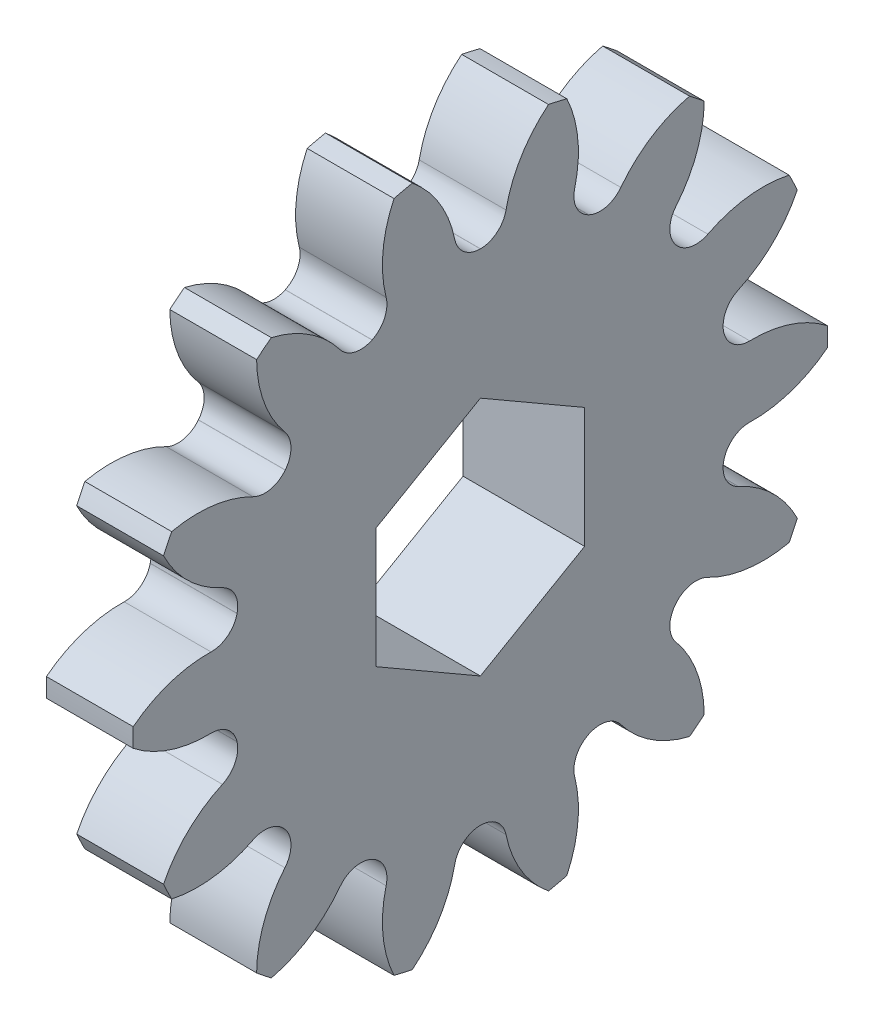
SolidWorks part; units mm, degrees
ref_plane "Front Plane" through (0, 0, 0) normal (0, 0, 1) x (1, 0, 0)
ref_plane "Top Plane" through (0, 0, 0) normal (0, 1, 0) x (1, 0, 0)
ref_plane "Right Plane" through (0, 0, 0) normal (1, 0, 0) x (0, 0, -1)
ref_plane "Plane1" through (0, 0, 0) normal (0, 0, -1) x (-1, 0, 0)
sketch "Sketch1" plane through (0, 0, 0) normal (0, 0, -1) x (-1, 0, 0)
  line L0 (-10, 40) -> (-10, 0)
  line L1 (-10, 0) -> (0, 0)
  line L2 (0, 0) -> (0, 40)
  line L3 (0, 40) -> (-10, 40)
  line L4 (-10, 0) -> (0, 0) construction
  dimension "D1" = 40
  dimension "D2" = 10
revolve "Revolve1" add sketch "Sketch1" angle 360 about L4
sketch "Sketch2" plane through (10, 0, 0) normal (1, 0, 0) x (0, 0, -1)
  arc A0 (35.5563, 18.3234) -> (25.7761, 30.5875) centre (0, 0) ccw
  arc A1 (25.7761, 30.5875) -> (20.7157, 19.934) centre (11.7766, 30.7085) cw
  arc A2 (20.7157, 19.934) -> (24.0439, 15.7606) centre (0, 0) cw
  arc A3 (24.0439, 15.7606) -> (35.5563, 18.3234) centre (32.5591, 4.648) cw
extrude "Cut-Extrude1" cut sketch "Sketch2" against normal through all
sketch "Sketch3" plane through (10, 0, 0) normal (1, 0, 0) x (0, 0, -1)
  arc A0 (39.9854, 1.0815) -> (36.4948, 16.3746) centre (0, 0) ccw
  arc A1 (36.4948, 16.3746) -> (27.3133, 8.9717) centre (23.9343, 22.5578) cw
  arc A2 (27.3133, 8.9717) -> (28.5011, 3.7676) centre (0, 0) cw
  arc A3 (28.5011, 3.7676) -> (39.9854, 1.0815) centre (31.3515, -9.9392) cw
extrude "Cut-Extrude2" cut sketch "Sketch3" against normal through all
sketch "Sketch4" plane through (10, 0, 0) normal (1, 0, 0) x (0, 0, -1)
  arc A0 (36.4948, -16.3746) -> (39.9854, -1.0815) centre (0, 0) ccw
  arc A1 (39.9854, -1.0815) -> (28.5011, -3.7676) centre (31.3515, 9.9392) cw
  arc A2 (28.5011, -3.7676) -> (27.3133, -8.9717) centre (0, 0) cw
  arc A3 (27.3133, -8.9717) -> (36.4948, -16.3746) centre (23.9343, -22.5578) cw
extrude "Cut-Extrude3" cut sketch "Sketch4" against normal through all
sketch "Sketch5" plane through (10, 0, 0) normal (1, 0, 0) x (0, 0, -1)
  arc A0 (25.7761, -30.5875) -> (35.5563, -18.3234) centre (0, 0) ccw
  arc A1 (35.5563, -18.3234) -> (24.0439, -15.7606) centre (32.5591, -4.648) cw
  arc A2 (24.0439, -15.7606) -> (20.7157, -19.934) centre (0, 0) cw
  arc A3 (20.7157, -19.934) -> (25.7761, -30.5875) centre (11.7766, -30.7085) cw
extrude "Cut-Extrude4" cut sketch "Sketch5" against normal through all
sketch "Sketch6" plane through (10, 0, 0) normal (1, 0, 0) x (0, 0, -1)
  arc A0 (9.952, -38.7422) -> (24.0849, -31.9362) centre (0, 0) ccw
  arc A1 (24.0849, -31.9362) -> (14.8245, -24.6321) centre (27.3181, -18.3146) cw
  arc A2 (14.8245, -24.6321) -> (10.0152, -26.9481) centre (0, 0) cw
  arc A3 (10.0152, -26.9481) -> (9.952, -38.7422) centre (-2.7136, -32.7771) cw
extrude "Cut-Extrude5" cut sketch "Sketch6" against normal through all
sketch "Sketch7" plane through (10, 0, 0) normal (1, 0, 0) x (0, 0, -1)
  arc A0 (-7.8432, -39.2235) -> (7.8432, -39.2235) centre (0, 0) ccw
  arc A1 (7.8432, -39.2235) -> (2.669, -28.6248) centre (16.6663, -28.3538) cw
  arc A2 (2.669, -28.6248) -> (-2.669, -28.6248) centre (0, 0) cw
  arc A3 (-2.669, -28.6248) -> (-7.8432, -39.2235) centre (-16.6663, -28.3538) cw
extrude "Cut-Extrude6" cut sketch "Sketch7" against normal through all
sketch "Sketch8" plane through (10, 0, 0) normal (1, 0, 0) x (0, 0, -1)
  arc A0 (-24.0849, -31.9362) -> (-9.952, -38.7422) centre (0, 0) ccw
  arc A1 (-9.952, -38.7422) -> (-10.0152, -26.9481) centre (2.7136, -32.7771) cw
  arc A2 (-10.0152, -26.9481) -> (-14.8245, -24.6321) centre (0, 0) cw
  arc A3 (-14.8245, -24.6321) -> (-24.0849, -31.9362) centre (-27.3181, -18.3146) cw
extrude "Cut-Extrude7" cut sketch "Sketch8" against normal through all
sketch "Sketch9" plane through (10, 0, 0) normal (1, 0, 0) x (0, 0, -1)
  arc A0 (-35.5563, -18.3234) -> (-25.7761, -30.5875) centre (0, 0) ccw
  arc A1 (-25.7761, -30.5875) -> (-20.7157, -19.934) centre (-11.7766, -30.7085) cw
  arc A2 (-20.7157, -19.934) -> (-24.0439, -15.7606) centre (0, 0) cw
  arc A3 (-24.0439, -15.7606) -> (-35.5563, -18.3234) centre (-32.5591, -4.648) cw
extrude "Cut-Extrude8" cut sketch "Sketch9" against normal through all
sketch "Sketch10" plane through (10, 0, 0) normal (1, 0, 0) x (0, 0, -1)
  arc A0 (-39.9854, -1.0815) -> (-36.4948, -16.3746) centre (0, 0) ccw
  arc A1 (-36.4948, -16.3746) -> (-27.3133, -8.9717) centre (-23.9343, -22.5578) cw
  arc A2 (-27.3133, -8.9717) -> (-28.5011, -3.7676) centre (0, 0) cw
  arc A3 (-28.5011, -3.7676) -> (-39.9854, -1.0815) centre (-31.3515, 9.9392) cw
extrude "Cut-Extrude9" cut sketch "Sketch10" against normal through all
sketch "Sketch11" plane through (10, 0, 0) normal (1, 0, 0) x (0, 0, -1)
  arc A0 (-36.4948, 16.3746) -> (-39.9854, 1.0815) centre (0, 0) ccw
  arc A1 (-39.9854, 1.0815) -> (-28.5011, 3.7676) centre (-31.3515, -9.9392) cw
  arc A2 (-28.5011, 3.7676) -> (-27.3133, 8.9717) centre (0, 0) cw
  arc A3 (-27.3133, 8.9717) -> (-36.4948, 16.3746) centre (-23.9343, 22.5578) cw
extrude "Cut-Extrude10" cut sketch "Sketch11" against normal through all
sketch "Sketch12" plane through (10, 0, 0) normal (1, 0, 0) x (0, 0, -1)
  arc A0 (-25.7761, 30.5875) -> (-35.5563, 18.3234) centre (0, 0) ccw
  arc A1 (-35.5563, 18.3234) -> (-24.0439, 15.7606) centre (-32.5591, 4.648) cw
  arc A2 (-24.0439, 15.7606) -> (-20.7157, 19.934) centre (0, 0) cw
  arc A3 (-20.7157, 19.934) -> (-25.7761, 30.5875) centre (-11.7766, 30.7085) cw
extrude "Cut-Extrude11" cut sketch "Sketch12" against normal through all
sketch "Sketch13" plane through (10, 0, 0) normal (1, 0, 0) x (0, 0, -1)
  arc A0 (-9.952, 38.7422) -> (-24.0849, 31.9362) centre (0, 0) ccw
  arc A1 (-24.0849, 31.9362) -> (-14.8245, 24.6321) centre (-27.3181, 18.3146) cw
  arc A2 (-14.8245, 24.6321) -> (-10.0152, 26.9481) centre (0, 0) cw
  arc A3 (-10.0152, 26.9481) -> (-9.952, 38.7422) centre (2.7136, 32.7771) cw
extrude "Cut-Extrude12" cut sketch "Sketch13" against normal through all
sketch "Sketch14" plane through (10, 0, 0) normal (1, 0, 0) x (0, 0, -1)
  arc A0 (7.8432, 39.2235) -> (-7.8432, 39.2235) centre (0, 0) ccw
  arc A1 (-7.8432, 39.2235) -> (-2.669, 28.6248) centre (-16.6663, 28.3538) cw
  arc A2 (-2.669, 28.6248) -> (2.669, 28.6248) centre (0, 0) cw
  arc A3 (2.669, 28.6248) -> (7.8432, 39.2235) centre (16.6663, 28.3538) cw
extrude "Cut-Extrude13" cut sketch "Sketch14" against normal through all
sketch "Sketch15" plane through (10, 0, 0) normal (1, 0, 0) x (0, 0, -1)
  arc A0 (24.0849, 31.9362) -> (9.952, 38.7422) centre (0, 0) ccw
  arc A1 (9.952, 38.7422) -> (10.0152, 26.9481) centre (-2.7136, 32.7771) cw
  arc A2 (10.0152, 26.9481) -> (14.8245, 24.6321) centre (0, 0) cw
  arc A3 (14.8245, 24.6321) -> (24.0849, 31.9362) centre (27.3181, 18.3146) cw
extrude "Cut-Extrude14" cut sketch "Sketch15" against normal through all
sketch "Sketch16" plane through (0, 0, 0) normal (-1, 0, 0) x (0, 0, 1)
  circle A0 centre (0, 0) radius 19.5
  dimension "D1" = 39
extrude "Boss-Extrude1" add sketch "Sketch16" along normal blind 4
sketch "Sketch17" plane through (10, 0, 0) normal (1, 0, 0) x (0, 0, -1)
  line L1 (0, 13.8564) -> (-12, 6.9282)
  line L2 (-12, 6.9282) -> (-12, -6.9282)
  line L3 (-12, -6.9282) -> (0, -13.8564)
  line L4 (0, -13.8564) -> (12, -6.9282)
  line L5 (12, -6.9282) -> (12, 6.9282)
  line L6 (12, 6.9282) -> (0, 13.8564)
  circle A0 centre (0, 0) radius 12 construction
  dimension "D1" = 24
fillet "Fillet1" radius 3 28 edges at (5, -15.7606, 24.0439) (5, 26.9481, 10.0152) (5, 8.9717, 27.3133) (5, 15.7606, -24.0439) (5, 24.6321, -14.8245) (5, 8.9717, -27.3133) (5, -3.7676, 28.5011) (5, 3.7676, -28.5011) (5, 19.934, 20.7157) (5, -3.7676, -28.5011) (5, 28.6248, -2.669) (5, -8.9717, -27.3133) (5, -19.934, 20.7157) (5, -15.7606, -24.0439) (5, -8.9717, 27.3133) (5, -19.934, -20.7157) (5, 3.7676, 28.5011) (5, -24.6321, -14.8245) (5, 15.7606, 24.0439) (5, -26.9481, -10.0152) (5, 24.6321, 14.8245) (5, -28.6248, -2.669) (5, 28.6248, 2.669) (5, -28.6248, 2.669) (5, 26.9481, -10.0152) (5, -26.9481, 10.0152) (5, 19.934, -20.7157) (5, -24.6321, 14.8245)
extrude "Cut-Extrude16" cut sketch "Sketch17" against normal through all
